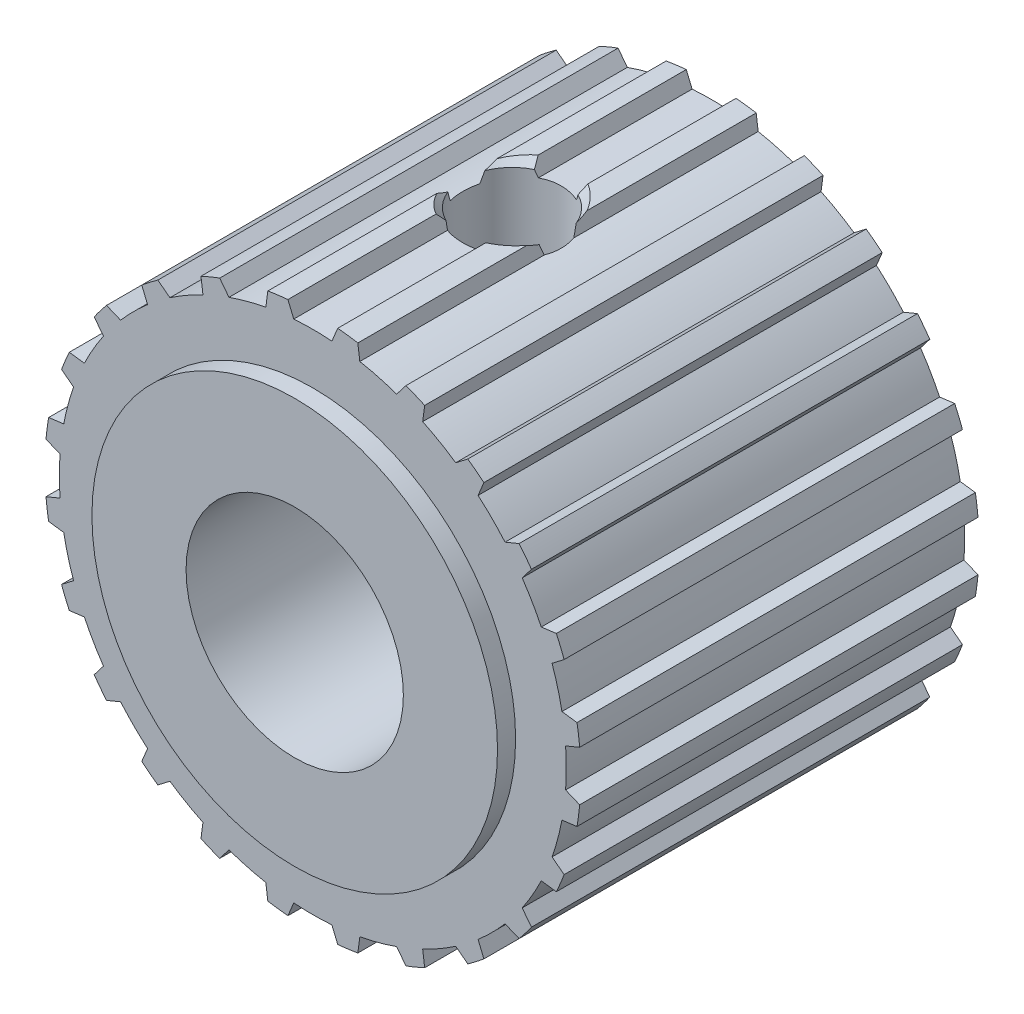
SolidWorks part; units mm, degrees
ref_plane "Face" through (0, 0, 0) normal (0, 0, 1) x (1, 0, 0)
ref_plane "Dessus" through (0, 0, 0) normal (0, 1, 0) x (1, 0, 0)
ref_plane "Droite" through (0, 0, 0) normal (1, 0, 0) x (0, 0, -1)
sketch "Esquisse1" plane through (0, 0, 0) normal (0, 0, 1) x (1, 0, 0)
  line L0 (0, 0) -> (0, 69.2099) construction
  circle A0 centre (0, 0) radius 7.5
  circle A1 centre (0, 0) radius 18.5
  dimension "D1" = 37
  dimension "D2" = 15
extrude "Base-Extrusion" add sketch "Esquisse1" along normal mid plane 30
sketch "Esquisse9" plane through (0, 0, 0) normal (1, 0, 0) x (0, 0, -1)
  line L0 (-15, 18.5) -> (15, 18.5)
  line L1 (-15, 18.5) -> (15, 18.5)
  line L2 (15, -18.5) -> (-15, -18.5)
  line L3 (15, -18.5) -> (-15, -18.5)
sketch "Esquisse2" plane through (0, 0, 15) normal (0, 0, 1) x (1, 0, 0)
  line L0 (0, 0) -> (-2.4147, 18.3417) construction
  line L1 (0, 0) -> (2.4147, 18.3417) construction
  line L2 (1.3172, 17.4504) -> (1.7188, 18.42)
  line L3 (-1.3168, 17.4504) -> (-1.7184, 18.42)
  line L4 (0.0002, 17.5) -> (0.0002, 18.5) construction
  arc A0 (1.3172, 17.4504) -> (-1.3168, 17.4504) centre (0, 0) ccw
  circle A1 centre (0, 0) radius 18.5 construction
  arc A3 (1.7188, 18.42) -> (-1.7184, 18.42) centre (0, 0) ccw
  dimension "D2" = 17.5
  dimension "D1" = 15
  dimension "D3" = 15
  dimension "D4" = 15
  dimension "D5" = 2.6339
  dimension "D6" = 0.9722
extrude "Enlèv. mat.-Extru.1" cut sketch "Esquisse2" against normal through all
pattern_circular "Répétition circulaire1" count 24 every 15
ref_plane "Plan4" through (0, 0, 0) normal (0, 0, 1) x (1, 0, 0)
sketch "Esquisse3" plane through (0, 0, -15) normal (0, 0, -1) x (-1, 0, 0)
  circle A0 centre (0, 0) radius 14
  circle A1 centre (0, 0) radius 18.5
  arc A2 (6.4277, -17.3475) -> (7.7218, -16.8114) centre (0, 0) ccw construction
  dimension "D1" = 28
extrude "Enlèv. mat.-Extru.2" cut sketch "Esquisse3" against normal blind 1.25
sketch "Esquisse4" plane through (0, 0, 15) normal (0, 0, 1) x (1, 0, 0)
  circle A0 centre (0, 0) radius 18.5
  circle A1 centre (0, 0) radius 14
  arc A2 (17.3476, 6.4273) -> (16.8116, 7.7215) centre (0, 0) ccw construction
  dimension "D1" = 28
extrude "Enlèv. mat.-Extru.3" cut sketch "Esquisse4" against normal blind 1.25
sketch "Esquisse5" plane through (0, 0, 13.75) normal (0, 0, 1) x (1, 0, 0)
  line L0 (1.5182, 17.9359) -> (2.3758, 20.0062) construction
  line L1 (-3.1756, 17.7177) -> (-2.9243, 19.6268) construction
  line L2 (1.7188, 18.42) -> (1.3172, 17.4504) construction
  line L3 (-3.1072, 18.2372) -> (-3.2442, 17.1967) construction
  arc A0 (1.5182, 17.9359) -> (-3.1756, 17.7177) centre (0, 0) ccw construction
  dimension "D1" = 36
sketch "Esquisse11" plane through (0, 0, 0) normal (1, 0, 0) x (0, 0, -1)
  line L0 (0, 18.5) -> (0, 0) construction
  line L1 (-15, 18.5) -> (15, 18.5) construction
ref_plane "Plan5" through (0, 18.5, 0) normal (0, -1, 0) x (1, 0, 0)
hole_wizard "Trou taraudé M8x1.251" positions "Esquisse13" profile "Esquisse12" tap size "M8x1.25" standard "ISO"
sketch "Esquisse13" plane through (0, 18.5, 0) normal (0, -1, 0) x (1, 0, 0)
  point P0 (0, 0)
sketch "Esquisse12" plane through (0, 18.5, 0) normal (1, 0, 0) x (0, 0, 1)
  line L0 (0, 0) -> (0, 11)
  line L1 (0, 11) -> (3.4, 11)
  line L2 (3.4, 11) -> (3.4, 0.6)
  line L3 (3.4, 0.6) -> (4, 0)
  line L5 (4, 0) -> (0, 0)
  line L6 (-3.4, 0.6) -> (-4, 0) construction
  line L11 (0, -6.35) -> (0, 107.95) construction
  dimension "Diamètre du trou pour taraudage jusqu'au prochain" = 6.8
  dimension "Profondeur du trou pour taraudage jusqu'au prochain" = 11
  dimension "Diamètre du fraisage entrant" = 8
  dimension "Angle du fraisage entrant" = 90
sketch "Esquisse8" plane through (0, 0, 0) normal (1, 0, 0) x (0, 0, -1)
  line L0 (-13.75, 19.4) -> (13.75, 19.4)
  line L1 (0, 0) -> (16.0577, 0) construction
  line L2 (-13.75, 14) -> (-13.75, -14) construction
  line L3 (13.75, -14) -> (13.75, 14) construction
  dimension "D1" = 38.8
surface "Surface-Révolution1" sketch "Esquisse8" parameters "D1"=360
sketch "Esquisse10" plane through (0, 0, 0) normal (1, 0, 0) x (0, 0, -1)
  line L0 (3.4, 7.5) -> (15, 7.5)
  line L1 (3.4, 7.5) -> (15, 7.5)
  line L2 (-15, 7.5) -> (-3.4, 7.5)
  line L3 (-15, 7.5) -> (-3.4, 7.5)
  line L4 (15, -7.5) -> (-15, -7.5)
  line L5 (15, -7.5) -> (-15, -7.5)
